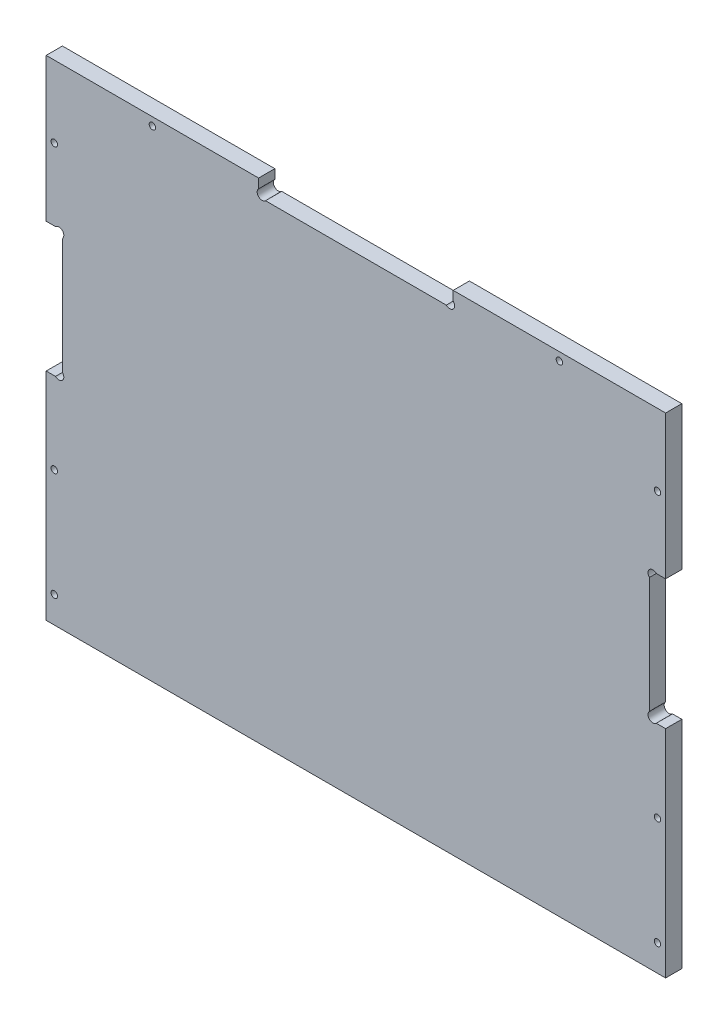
SolidWorks part; units mm, degrees
ref_plane "Plan de face" through (0, 0, 0) normal (0, 0, 1) x (1, 0, 0)
ref_plane "Plan de dessus" through (0, 0, 0) normal (0, 1, 0) x (1, 0, 0)
ref_plane "Plan de droite" through (0, 0, 0) normal (1, 0, 0) x (0, 0, -1)
sketch "Esquisse1" plane through (0, 0, 0) normal (0, 0, 1) x (1, 0, 0)
  line L0 (0, -113.4331) -> (0, 32.4469)
  line L1 (-95.5, -113.4331) -> (95.5, -113.4331)
  line L2 (-27.8787, 32.4469) -> (27.8787, 32.4469)
  line L3 (-30, 37.4469) -> (-95.5, 37.4469)
  line L4 (-95.5, 37.4469) -> (-95.5, -6.8431)
  line L5 (-95.5, -6.8431) -> (-92.6213, -6.8431)
  line L6 (-90.5, -8.9644) -> (-90.5, -44.7218)
  line L7 (-92.6213, -46.8431) -> (-95.5, -46.8431)
  line L8 (-95.5, -46.8431) -> (-95.5, -113.4331)
  line L9 (-30, 34.5682) -> (-30, 37.4469)
  line L10 (30, 32.4469) -> (95.5, 37.4469) construction
  line L11 (-90.5, -6.8431) -> (-101.6222, -17.9653) construction
  line L12 (-90.5, -46.8431) -> (-101.8247, -35.5184) construction
  line L13 (-90.5, -46.8431) -> (-95.5, -97.0731) construction
  line L14 (-95.5, -97.0731) -> (-90.5, -113.4331) construction
  line L15 (-90.5, -6.8431) -> (-95.5, 37.4469) construction
  line L16 (-30, 32.4469) -> (-95.5, 37.4469) construction
  line L17 (90.5, -6.8431) -> (95.5, 37.4469) construction
  line L18 (95.5, -97.0731) -> (90.5, -113.4331) construction
  line L19 (90.5, -46.8431) -> (95.5, -97.0731) construction
  line L20 (90.5, -46.8431) -> (101.8247, -35.5184) construction
  line L21 (90.5, -6.8431) -> (101.6222, -17.9653) construction
  line L22 (30, 34.5682) -> (30, 37.4469)
  line L23 (95.5, -46.8431) -> (95.5, -113.4331)
  line L24 (92.6213, -46.8431) -> (95.5, -46.8431)
  line L25 (90.5, -8.9644) -> (90.5, -44.7218)
  line L26 (95.5, -6.8431) -> (92.6213, -6.8431)
  line L27 (95.5, 37.4469) -> (95.5, -6.8431)
  line L28 (30, 37.4469) -> (95.5, 37.4469)
  line L29 (-30, 32.4469) -> (-19.7343, 42.7126) construction
  line L30 (30, 32.4469) -> (21.6307, 40.8161) construction
  circle A0 centre (93, 15.3019) radius 1
  arc A1 (-90.5, -8.9644) -> (-92.6213, -6.8431) centre (-91.5607, -7.9038) ccw
  arc A2 (-92.6213, -46.8431) -> (-90.5, -44.7218) centre (-91.5607, -45.7825) ccw
  circle A3 centre (-93, -71.9581) radius 1
  circle A4 centre (-93, -105.2531) radius 1
  circle A5 centre (-62.75, 34.9469) radius 1
  circle A6 centre (-93, 15.3019) radius 1
  circle A7 centre (62.75, 34.9469) radius 1
  circle A8 centre (93, -105.2531) radius 1
  circle A9 centre (93, -71.9581) radius 1
  arc A10 (92.6213, -46.8431) -> (90.5, -44.7218) centre (91.5607, -45.7825) cw
  arc A11 (90.5, -8.9644) -> (92.6213, -6.8431) centre (91.5607, -7.9038) cw
  arc A12 (-30, 34.5682) -> (-27.8787, 32.4469) centre (-28.9393, 33.5075) ccw
  arc A13 (27.8787, 32.4469) -> (30, 34.5682) centre (28.9393, 33.5075) ccw
  dimension "D11" = 16.36
  dimension "D12" = 150.88
  dimension "D2" = 30
  dimension "D3" = 95.5
  dimension "D4" = 44.29
  dimension "D5" = 40
  dimension "D6" = 5
  dimension "D7" = 5
  dimension "D8" = 5
  dimension "D9" = 45
  dimension "D10" = 45
  dimension "D13" = 45
  dimension "D14" = 45
extrude "Boss.-Extru.1" add sketch "Esquisse1" along normal blind 5
sketch "Esquisse3" plane through (0, 0, 5) normal (0, 0, 1) x (1, 0, 0)
  line L0 (-98.8207, -97.0731) -> (98.0364, -97.0731)
  line L2 (-95.5, -113.4331) -> (95.5, -113.4331) construction
  dimension "D1" = 16.36
